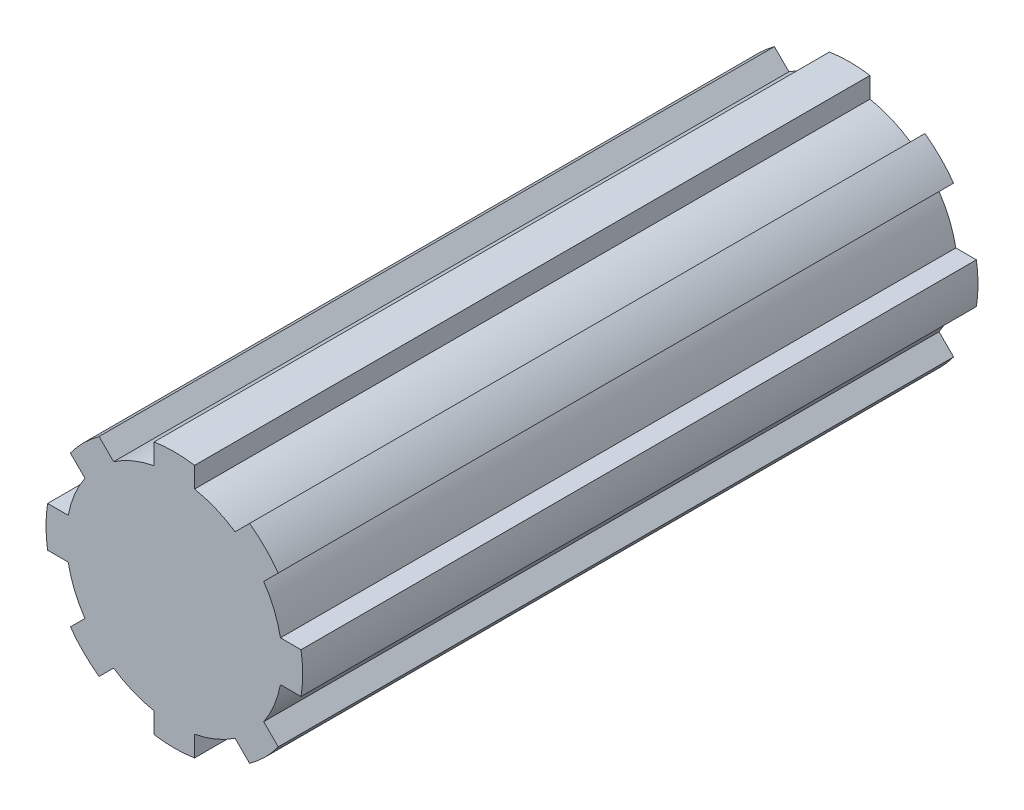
SolidWorks part; units mm, degrees
ref_plane "Front" through (0, 0, 0) normal (0, 0, 1) x (1, 0, 0)
ref_plane "Top" through (0, 0, 0) normal (0, 1, 0) x (1, 0, 0)
ref_plane "Right" through (0, 0, 0) normal (1, 0, 0) x (0, 0, -1)
sketch "Sketch1" plane through (0, 0, 0) normal (0, 0, 1) x (1, 0, 0)
  circle A0 centre (0, 0) radius 16
  dimension "d" = 32
extrude "BaseKey" add sketch "Sketch1" along normal mid plane 100
sketch "Sketch2" plane through (0, 0, 0) normal (0, 0, 1) x (1, 0, 0)
  line L0 (0, 9.5196) -> (0, -9.8317) construction
  line L1 (-3, 18.7617) -> (-3, 0)
  line L2 (-3, 0) -> (3, 0)
  line L3 (3, 0) -> (3, 18.7617)
  arc A0 (3, 18.7617) -> (-3, 18.7617) centre (0, 0) ccw
  dimension "D" = 38
  dimension "B" = 6
  dimension "B1" = 3
extrude "Rectangle" add sketch "Sketch2" along normal mid plane 100
pattern_circular "RectanglePat" count 8 over 360 about axis through (0, 0, 0) along (0, 0, 1) of "Rectangle"
equation "\"B1@Sketch2\" = \"B@Sketch2\" / 2"
equation "\"L1@Rectangle\" = \"L@BaseKey\""
